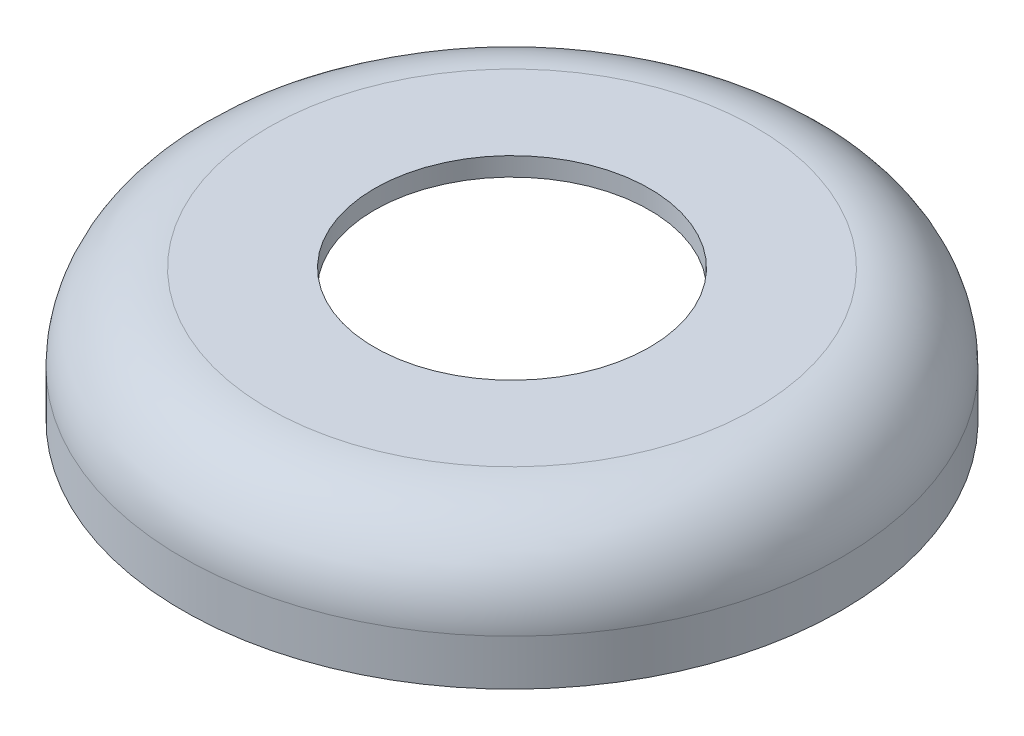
SolidWorks part; units mm, degrees
ref_plane "Front Plane" through (0, 0, 0) normal (0, 0, 1) x (1, 0, 0)
ref_plane "Top Plane" through (0, 0, 0) normal (0, 1, 0) x (1, 0, 0)
ref_plane "Right Plane" through (0, 0, 0) normal (1, 0, 0) x (0, 0, -1)
sketch "Sketch1" plane through (0, 0, 0) normal (0, 0, 1) x (1, 0, 0)
  line L1 (0, 0) -> (8.5, 0)
  line L2 (0, 0) -> (0, -4.6)
  line L3 (0, -4.6) -> (11.5, -4.6)
  line L4 (11.5, -3) -> (11.5, -4.6)
  arc A0 (8.5, 0) -> (11.5, -3) centre (8.5, -3) cw
  dimension "D3" = 3
  dimension "D1" = 4.6
  dimension "D2" = 11.5
revolve "Revolve1" add sketch "Sketch1" angle 360 about L2
shell "Shell1" thickness 0.65
sketch "Sketch2" plane through (0, 0, 0) normal (0, 1, 0) x (1, 0, 0)
  circle A0 centre (0, 0) radius 4.8
  dimension "D1" = 9.6
extrude "Cut-Extrude1" cut sketch "Sketch2" against normal up to body separate body
